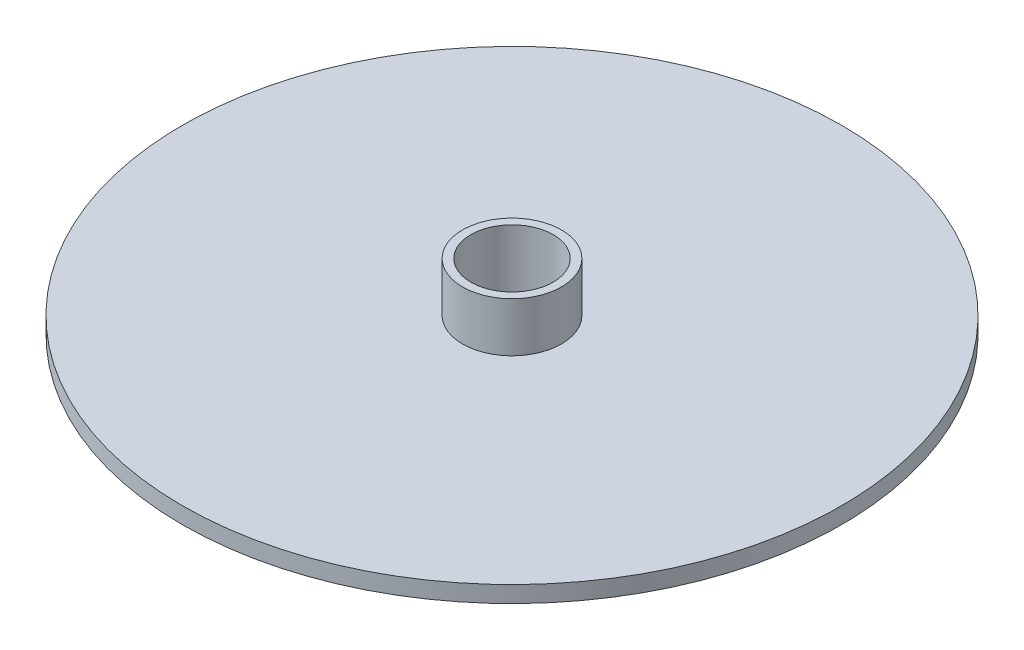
SolidWorks part; units mm, degrees
ref_plane "Front Plane" through (0, 0, 0) normal (0, 0, 1) x (1, 0, 0)
ref_plane "Top Plane" through (0, 0, 0) normal (0, 1, 0) x (1, 0, 0)
ref_plane "Right Plane" through (0, 0, 0) normal (1, 0, 0) x (0, 0, -1)
sketch "Sketch1" plane through (0, 0, 0) normal (0, 1, 0) x (1, 0, 0)
  circle A0 centre (0, 0) radius 1000
  dimension "D1" = 2000
extrude "Boss-Extrude1" add sketch "Sketch1" along normal blind 50
sketch "Sketch4" plane through (0, 50, 0) normal (0, 1, 0) x (1, 0, 0)
  circle A0 centre (0, 0) radius 125
  dimension "D1" = 250
extrude "Cut-Extrude5" cut sketch "Sketch4" against normal blind 50
sketch "Sketch5" plane through (0, 50, 0) normal (0, 1, 0) x (1, 0, 0)
  circle A0 centre (0, 0) radius 150
  circle A1 centre (0, 0) radius 125
extrude "Boss-Extrude2" add sketch "Sketch5" along normal blind 150
